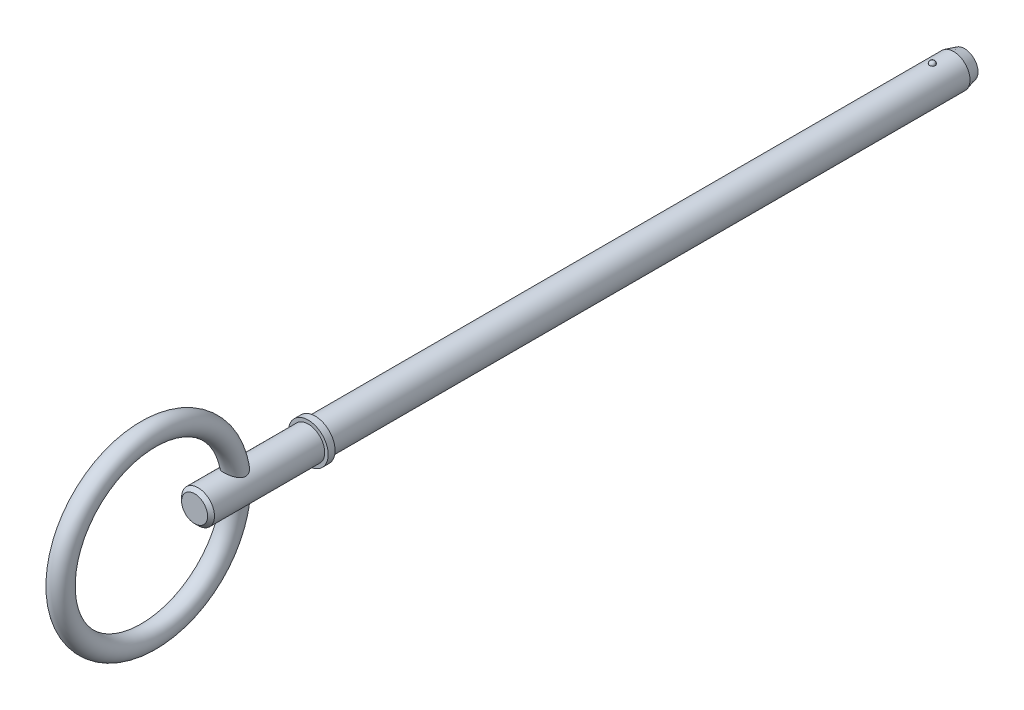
SolidWorks part; units mm, degrees
ref_plane "Front Plane" through (0, 0, 0) normal (0, 0, 1) x (1, 0, 0)
ref_plane "Top Plane" through (0, 0, 0) normal (0, 1, 0) x (1, 0, 0)
ref_plane "Right Plane" through (0, 0, 0) normal (1, 0, 0) x (0, 0, -1)
sketch "Sketch2" plane through (0, 0, 0) normal (0, 0, 1) x (1, 0, 0)
  circle A0 centre (0, 0) radius 2.38
  point P3 (0, 2.38)
  dimension "D1" = 4.76
extrude "Boss-Extrude1" add sketch "Sketch2" along normal blind 88.9
sketch "Sketch3" plane through (0, 0, 0) normal (0, 0, -1) x (-1, 0, 0)
  circle A0 centre (0, 0) radius 2.38
  dimension "D1" = 4.76
extrude "Boss-Extrude2" add sketch "Sketch3" along normal blind 5.08
chamfer "Chamfer1" distance 1.586 angle 15 1 edges at (-2.38, 0, -5.08)
sketch "Sketch18" plane through (0, 0, 0) normal (1, 0, 0) x (0, 0, -1)
  line L0 (3.494, 2.38) -> (-88.9, 2.38) construction
  line L1 (0.42, 2.8) -> (0.42, 1.96)
  line L2 (-88.9, -2.38) -> (3.494, -2.38) construction
  arc A0 (0.42, 2.8) -> (0.42, 1.96) centre (0.42, 2.38) ccw
  point P4 (0, 2.38)
  dimension "D1" = 5.18
revolve "Revolve1" add sketch "Sketch18" angle 360 about L1
sketch "Sketch19" plane through (0, 0, 0) normal (1, 0, 0) x (0, 0, -1)
  line L0 (-33.7288, 0) -> (-46.4542, 0) construction
sketch "Sketch20" plane through (0, 0, 0) normal (1, 0, 0) x (0, 0, -1)
  line L0 (-88.9, 0) -> (-88.9, 2.88)
  line L1 (-88.9, 2.38) -> (-88.9, -2.38) construction
  line L2 (-88.9, 2.88) -> (-89.9, 2.88)
  line L3 (-89.9, 2.88) -> (-89.9, 0)
  line L4 (-33.7288, 0) -> (-46.4542, 0) construction
  line L5 (-89.9, 0) -> (-88.9, 0)
  dimension "D1" = 2.88
  dimension "D2" = 1
revolve "Revolve2" add sketch "Sketch20" angle 360 about L0
sketch "Sketch21" plane through (0, 0, 88.9) normal (0, 0, -1) x (-1, 0, 0)
  circle A0 centre (0, 0) radius 2.38
  dimension "D1" = 4.76
extrude "Boss-Extrude3" add sketch "Sketch21" against normal blind 17.45
chamfer "Chamfer2" distance 0.5 angle 45 1 edges at (-2.38, 0, 106.35)
sketch "Sketch23" plane through (0, 0, 0) normal (1, 0, 0) x (0, 0, -1)
  line L0 (-106.35, 1.88) -> (-106.35, -1.88) construction
  circle A0 centre (-113.05, 0) radius 12.7
  point P2 (-100.35, 0)
  dimension "D1" = 25.4
  dimension "D2" = 6
sketch "Sketch24" plane through (0, 0, 0) normal (0, 1, 0) x (1, 0, 0)
  circle A0 centre (0, -100.35) radius 1.5
  dimension "D1" = 3
sweep "Sweep1" add profiles "Sketch24" path "Sketch23"
